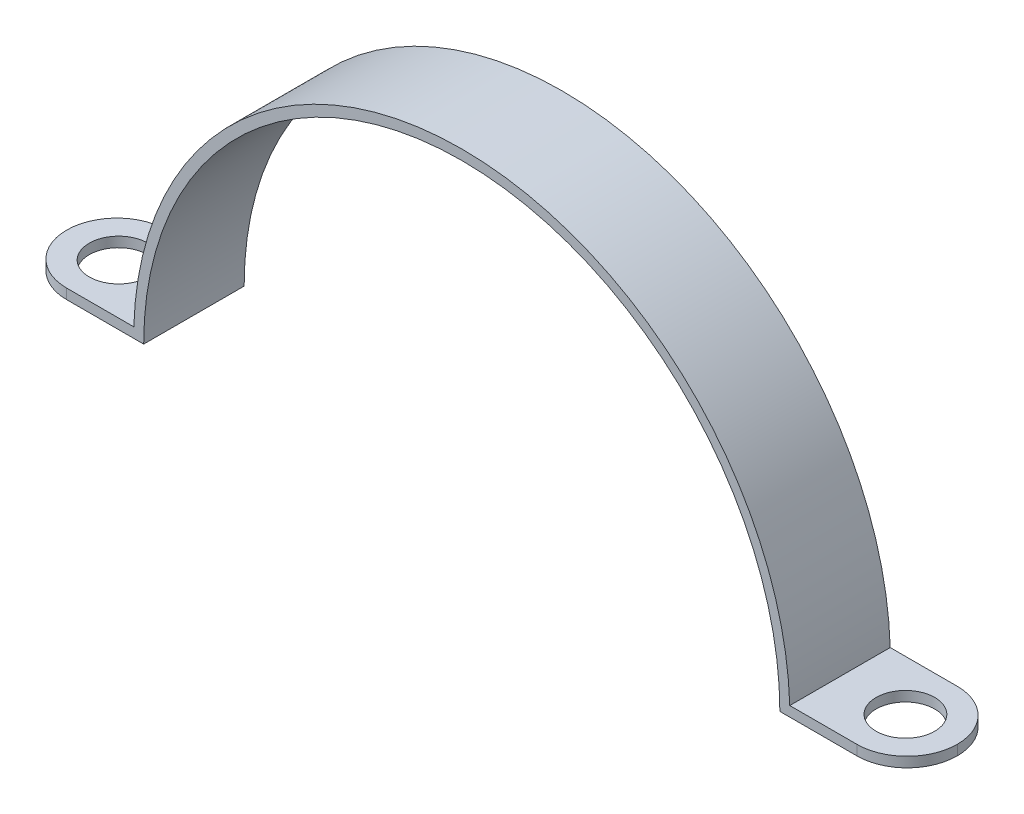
SolidWorks part; units mm, degrees
ref_plane "Plan de face" through (0, 0, 0) normal (0, 0, 1) x (1, 0, 0)
ref_plane "Plan de dessus" through (0, 0, 0) normal (0, 1, 0) x (1, 0, 0)
ref_plane "Plan de droite" through (0, 0, 0) normal (1, 0, 0) x (0, 0, -1)
sketch "Esquisse1" plane through (0, 0, 0) normal (0, 0, 1) x (1, 0, 0)
  line L0 (-26.6, 0) -> (-19, 0)
  line L1 (-26.6, 0.6) -> (-26.6, 0)
  line L2 (26.6, 0.6) -> (26.6, 0)
  line L3 (19, 0) -> (26.6, 0)
  line L5 (19.5908, 0.6) -> (26.6, 0.6)
  line L6 (-26.6, 0.6) -> (-19.5908, 0.6)
  line L7 (26.6, 6.1402) -> (26.6, 0) construction
  line L8 (-26, 0.6) -> (-19.5908, 0.6) construction
  line L9 (19.5908, 0.6) -> (26, 0.6) construction
  line L10 (-26, 6.1402) -> (-26, 0.6) construction
  line L11 (-26.6, 6.1402) -> (-26.6, 0) construction
  line L12 (26, 6.1402) -> (26, 0.6) construction
  arc A0 (19, 0) -> (-19, 0) centre (0, 0) ccw
  arc A1 (19.5908, 0.6) -> (-19.5908, 0.6) centre (0, 0) ccw
  dimension "D1" = 38
  dimension "D2" = 53.2
  dimension "D3" = 26.6
  dimension "D4" = 0.6
extrude "Boss.-Extru.1" add sketch "Esquisse1" along normal mid plane 6
fillet "Congé1" radius 3 4 edges at (-26.6, 0.3, -3) (-26.6, 0.3, 3) (26.6, 0.3, -3) (26.6, 0.3, 3)
sketch "Esquisse2" plane through (0, 0.6, 0) normal (0, 1, 0) x (1, 0, 0)
  circle A0 centre (-23.5, 0) radius 1.75
  circle A1 centre (23.5, 0) radius 1.75
  dimension "D1" = 3.5
  dimension "D2" = 3.5
  dimension "D3" = 23.5
  dimension "D4" = 47
extrude "Enlèv. mat.-Extru.1" cut sketch "Esquisse2" against normal through all
